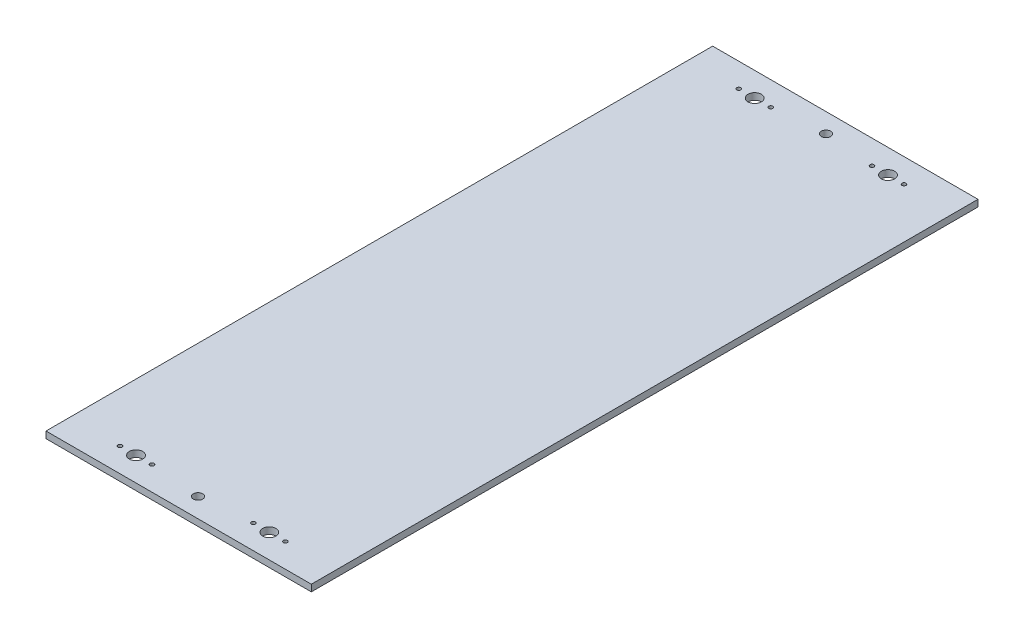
SolidWorks part; units mm, degrees
ref_plane "Спереди" through (0, 0, 0) normal (0, 0, 1) x (1, 0, 0)
ref_plane "Сверху" through (0, 0, 0) normal (0, 1, 0) x (1, 0, 0)
ref_plane "Справа" through (0, 0, 0) normal (1, 0, 0) x (0, 0, -1)
sketch "Эскиз2" plane through (0, 0, 0) normal (0, 1, 0) x (1, 0, 0)
  line L1 (199, 500) -> (-199, 500)
  line L2 (199, 500) -> (199, -500)
  line L3 (199, -500) -> (-199, -500)
  line L4 (-199, 500) -> (-199, -500)
  line L5 (199, 500) -> (-199, -500) construction
  line L6 (199, -500) -> (-199, 500) construction
  point P0 (0, 0)
  dimension "D1" = 1000
  dimension "D2" = 398
extrude "Бобышка-Вытянуть1" add sketch "Эскиз2" along normal blind 10
sketch "Эскиз3"
  line L5 (-199, 500) -> (-199, -500) construction
  line L6 (-199, -500) -> (199, -500) construction
  circle A0 centre (-100, 464) radius 10
  circle A1 centre (100, 464) radius 10
  circle A2 centre (0, 471) radius 7
  circle A3 centre (-124, 464) radius 3
  circle A4 centre (-76, 464) radius 3
  circle A5 centre (76, 464) radius 3
  circle A6 centre (124, 464) radius 3
  circle A7 centre (124, -464) radius 3
  circle A8 centre (76, -464) radius 3
  circle A9 centre (-76, -464) radius 3
  circle A10 centre (-124, -464) radius 3
  circle A11 centre (0, -471) radius 7
  circle A12 centre (100, -464) radius 10
  circle A13 centre (-100, -464) radius 10
other "Выровнять группу1" parameters "D1"=31.4302, "D2"=31.4302, "D3"=31.3217, "D4"=20, "D5"=20, "D6"=398, "D7"=1000, "D8"=1000, "D9"=91.3548, "D10"=45.0203, "D11"=45.3078, "D12"=398, "D13"=48, "D14"=29, "D15"=964, "D16"=971
other "Выровнять группу2"
extrude "Вырез-Вытянуть1" cut sketch "Эскиз3" against normal blind 10
